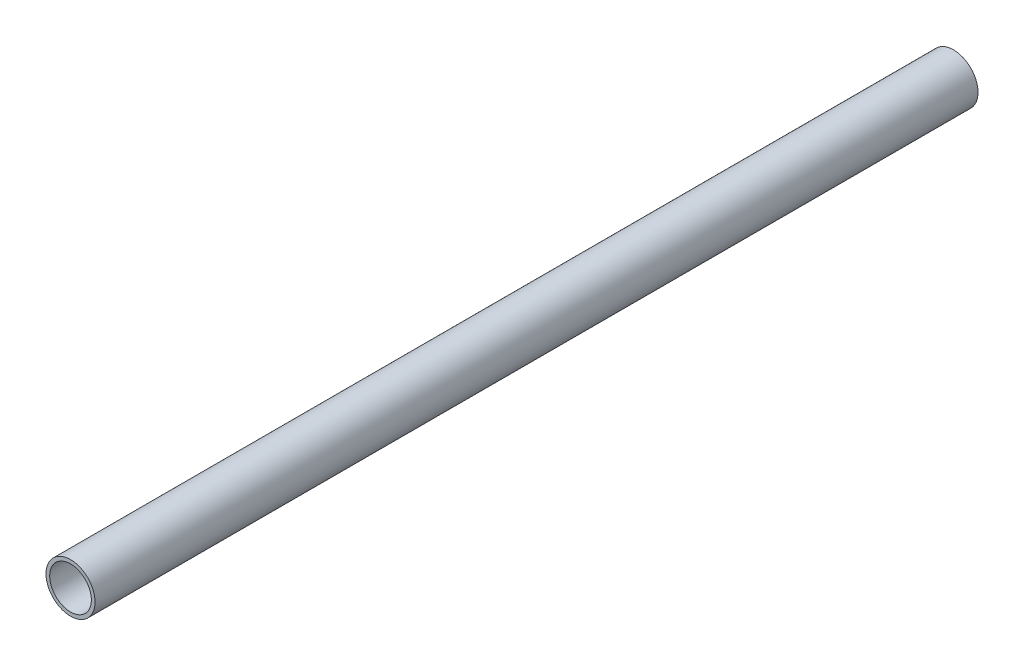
SolidWorks part; units mm, degrees
ref_plane "Plan1" through (0, 0, 0) normal (0, 0, 1) x (1, 0, 0)
ref_plane "Plan2" through (0, 0, 0) normal (0, 1, 0) x (1, 0, 0)
ref_plane "Plan3" through (0, 0, 0) normal (1, 0, 0) x (0, 0, -1)
sketch "Esquisse1" plane through (0, 0, 0) normal (0, 0, 1) x (1, 0, 0)
  circle A0 centre (0, 0) radius 10
  dimension "D1" = 20
extrude "Base-Extru.-Mince" add sketch "Esquisse1" along normal blind 360 thin
